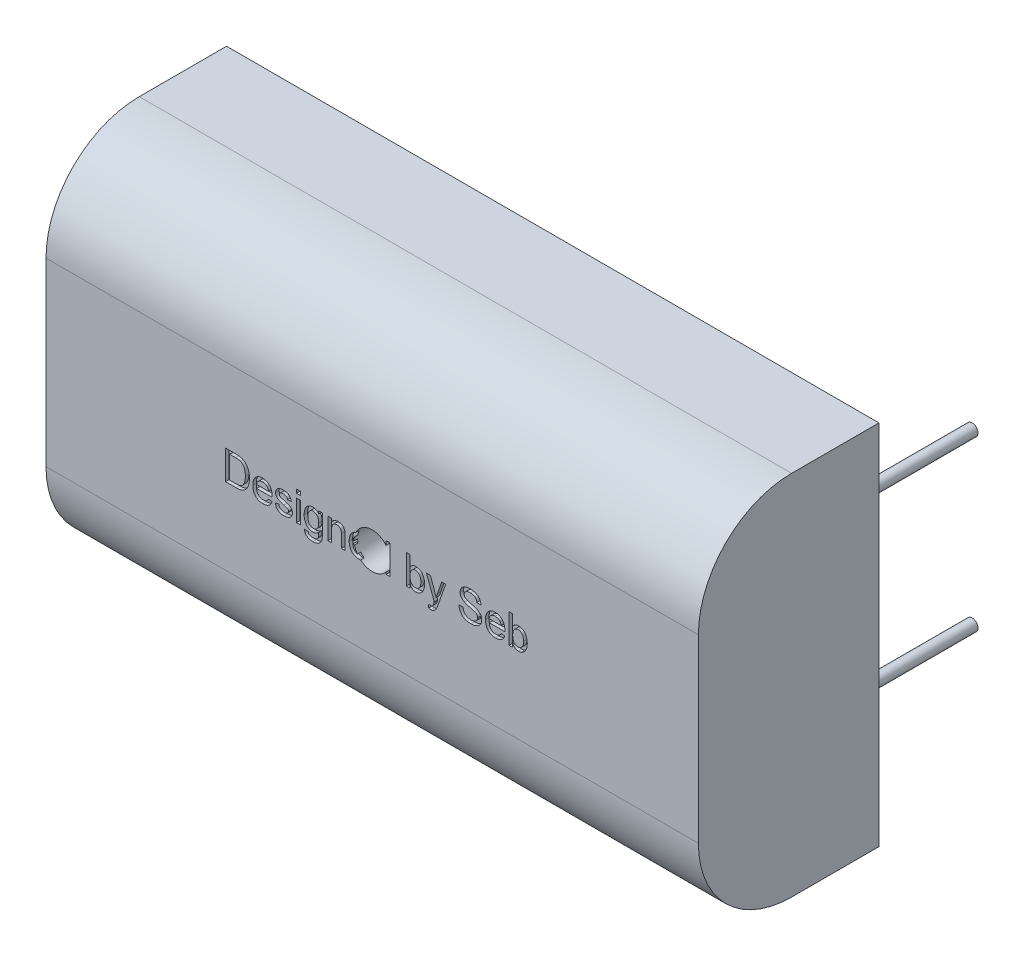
SolidWorks part; units mm, degrees
ref_plane "Front Plane" through (0, 0, 0) normal (0, 0, 1) x (1, 0, 0)
ref_plane "Top Plane" through (0, 0, 0) normal (0, 1, 0) x (1, 0, 0)
ref_plane "Right Plane" through (0, 0, 0) normal (1, 0, 0) x (0, 0, -1)
sketch "Sketch1" plane through (0, 0, 0) normal (1, 0, 0) x (0, 0, -1)
  line L1 (7.75, -15.75) -> (-7.75, -15.75)
  line L2 (7.75, -15.75) -> (7.75, 15.75)
  line L3 (7.75, 15.75) -> (-7.75, 15.75)
  line L4 (-7.75, -15.75) -> (-7.75, 15.75)
  line L5 (7.75, -15.75) -> (-7.75, 15.75) construction
  line L6 (7.75, 15.75) -> (-7.75, -15.75) construction
  point P0 (0, 0)
  dimension "D1" = 15.5
  dimension "D2" = 31.5
extrude "Boss-Extrude1" add sketch "Sketch1" along normal mid plane 56
fillet "Fillet1" radius 8 2 edges at (0, -15.75, 7.75) (0, 15.75, 7.75)
sketch "Sketch2" plane through (0, 0, -7.75) normal (0, 0, -1) x (-1, 0, 0)
  line L0 (-24, 15.75) -> (-24, -15.75) construction
  line L1 (-28, 15.75) -> (28, 15.75) construction
  line L2 (-28, -15.75) -> (28, -15.75) construction
  line L3 (-28, -15.75) -> (-28, 15.75) construction
  line L4 (-31.6502, 0) -> (31.6117, 0) construction
  line L5 (55, 0) -> (-55, 0) construction
  circle A0 centre (-24, 7.25) radius 0.5
  circle A1 centre (-24, -7.25) radius 0.5
  dimension "D2" = 1
  dimension "D1" = 4
  dimension "D3" = 14.5
extrude "Boss-Extrude2" add sketch "Sketch2" along normal blind 12 contours A0
sketch "Sketch3" plane through (0, 0, 7.75) normal (0, 0, 1) x (1, 0, 0)
  text T0 "Designed by Seb"
extrude "Cut-Extrude1" cut sketch "Sketch3" against normal blind 0.3
sketch "Sketch4" plane through (0, 0, -7.75) normal (0, 0, -1) x (-1, 0, 0)
  circle A0 centre (0, 0) radius 1.55
  dimension "D1" = 3.1
extrude "Cut-Extrude2" cut sketch "Sketch4" against normal through all
